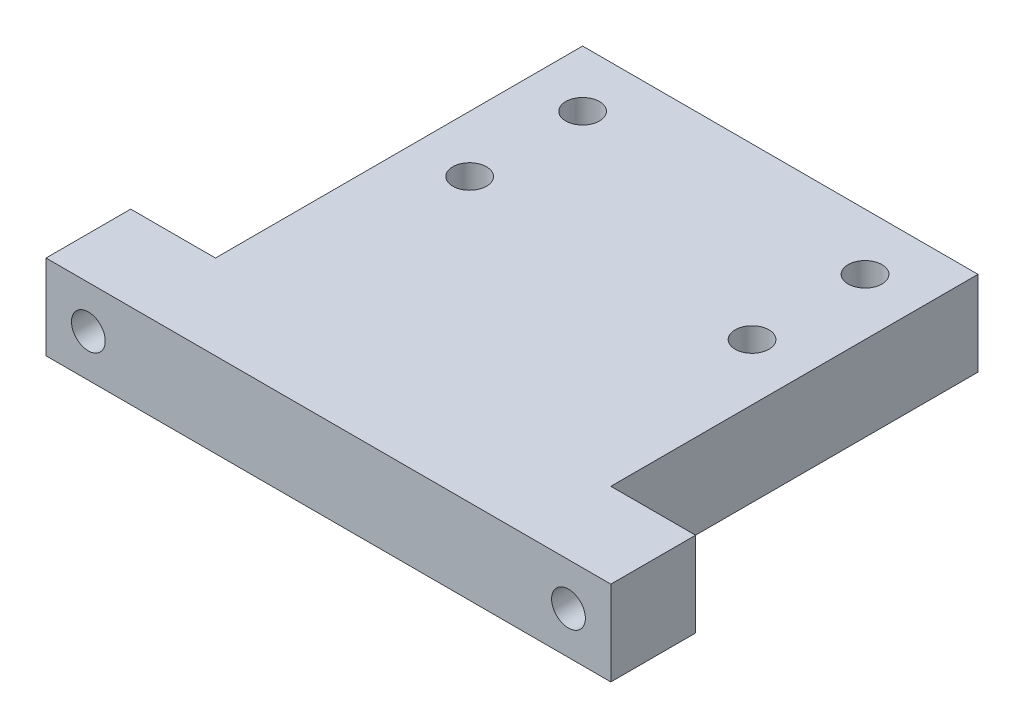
SolidWorks part; units mm, degrees
ref_plane "Front" through (0, 0, 0) normal (0, 0, 1) x (1, 0, 0)
ref_plane "Top" through (0, 0, 0) normal (0, 1, 0) x (1, 0, 0)
ref_plane "Right" through (0, 0, 0) normal (1, 0, 0) x (0, 0, -1)
sketch "Sketch1" plane through (0, 0, 0) normal (0, 1, 0) x (1, 0, 0)
  line L0 (-26.9875, 0) -> (-26.9875, 44.45) construction
  line L1 (-31.75, 0) -> (31.75, 0)
  line L2 (-31.75, 0) -> (-31.75, 9.525)
  line L3 (-22.225, 50.8) -> (22.225, 50.8)
  line L4 (31.75, 0) -> (31.75, 9.525)
  line L5 (0, 0) -> (0, 50.8) construction
  line L7 (-31.75, 9.525) -> (-22.225, 9.525)
  line L8 (-22.225, 50.8) -> (-22.225, 9.525)
  line L11 (31.75, 9.525) -> (22.225, 9.525)
  line L12 (22.225, 50.8) -> (22.225, 9.525)
  line L13 (26.9875, 44.45) -> (26.9875, 0) construction
  dimension "D1" = 63.5
  dimension "D2" = 50.8
  dimension "D3" = 53.975
  dimension "D4" = 9.525
extrude "Extrude1" add sketch "Sketch1" along normal mid plane 9.525
hole_wizard "#6 Clearance Hole1" positions "Sketch3" profile "Sketch2" hole size "#6" standard "Ansi Inch"
sketch "Sketch3" plane through (0, 0, -9.525) normal (0, 0, -1) x (-1, 0, 0)
  line L0 (0, 0) -> (0, 10.9602) construction
  line L2 (-26.9875, 4.7625) -> (-26.9875, -4.7625) construction
  line L3 (-31.75, 4.7625) -> (-22.225, 4.7625) construction
  line L4 (-31.75, -4.7625) -> (-22.225, -4.7625) construction
  line L5 (-26.9875, -4.7625) -> (-31.75, 0) construction
  line L6 (-31.75, 4.7625) -> (-31.75, -4.7625) construction
  line L7 (-31.75, 0) -> (-22.225, 0) construction
  line L8 (-22.225, 4.7625) -> (-22.225, -4.7625) construction
  point P0 (-26.9875, 0)
  point P6 (26.9875, 0)
sketch "Sketch2" plane through (26.9875, 0, -9.525) normal (1, 0, 0) x (0, 1, 0)
  line L0 (0, 0) -> (0, 9.525)
  line L1 (0, 9.525) -> (1.8986, 9.525)
  line L2 (1.8986, 9.525) -> (1.8986, 0)
  line L5 (1.8986, 0) -> (0, 0)
  line L11 (0, -6.35) -> (0, 107.95) construction
  dimension "Thru Hole Dia." = 3.7973
  dimension "Thru Hole Depth" = 9.525
hole_wizard "#6 Clearance Hole2" positions "Sketch6" profile "Sketch5" hole size "#6" standard "Ansi Inch"
sketch "Sketch6" plane through (0, 4.7625, 0) normal (0, 1, 0) x (-1, 0, 0)
  line L0 (0, 0) -> (0, -50.8) construction
  line L1 (31.75, 0) -> (-31.75, 0) construction
  line L2 (-22.225, -50.8) -> (22.225, -50.8) construction
  point P0 (-15.875, -44.45)
  point P9 (15.875, -44.45)
  point P10 (-15.875, -31.75)
  point P13 (15.875, -31.75)
  dimension "D1" = 31.75
  dimension "D2" = 12.7
  dimension "D3" = 6.35
sketch "Sketch5" plane through (15.875, 4.7625, -44.45) normal (1, 0, 0) x (0, 0, 1)
  line L0 (0, 0) -> (0, 9.525)
  line L1 (0, 9.525) -> (1.8986, 9.525)
  line L2 (1.8986, 9.525) -> (1.8986, 0)
  line L5 (1.8986, 0) -> (0, 0)
  line L11 (0, -6.35) -> (0, 107.95) construction
  dimension "Thru Hole Dia." = 3.7973
  dimension "Thru Hole Depth" = 9.525
